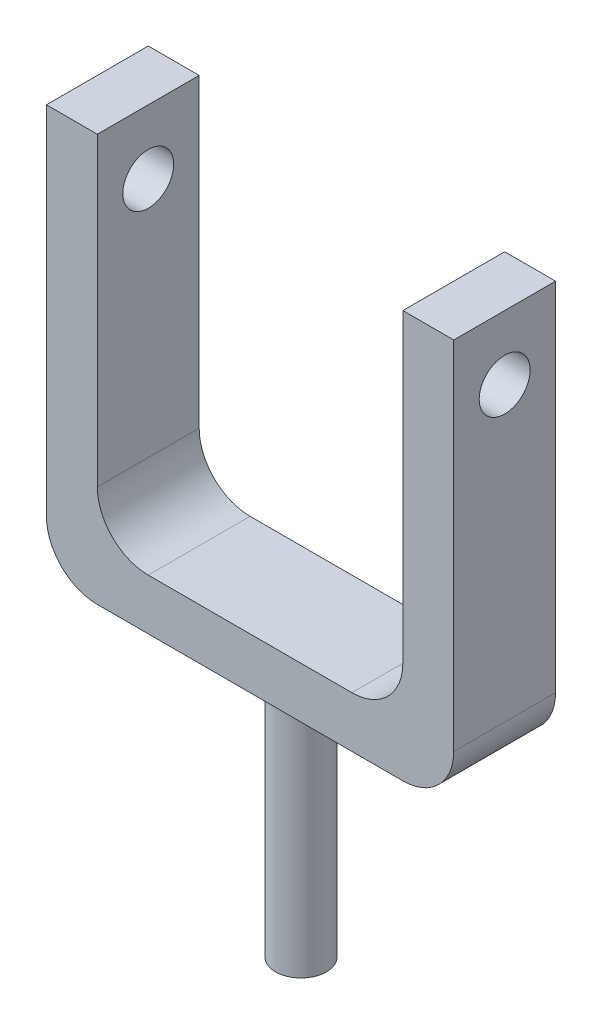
SolidWorks part; units mm, degrees
ref_plane "Front Plane" through (0, 0, 0) normal (0, 0, 1) x (1, 0, 0)
ref_plane "Top Plane" through (0, 0, 0) normal (0, 1, 0) x (1, 0, 0)
ref_plane "Right Plane" through (0, 0, 0) normal (1, 0, 0) x (0, 0, -1)
sketch "Sketch1" plane through (0, 0, 0) normal (0, 0, 1) x (1, 0, 0)
  line L0 (-38.1, 0) -> (38.1, 0)
  line L1 (50.8, 12.7) -> (50.8, 101.6)
  line L2 (50.8, 101.6) -> (38.1, 101.6)
  line L3 (38.1, 101.6) -> (38.1, 25.4)
  line L4 (25.4, 12.7) -> (-25.4, 12.7)
  line L5 (-38.1, 25.4) -> (-38.1, 101.6)
  line L6 (-38.1, 101.6) -> (-50.8, 101.6)
  line L7 (-50.8, 101.6) -> (-50.8, 12.7)
  line L8 (0, 12.7) -> (0, 0) construction
  arc A0 (-38.1, 25.4) -> (-25.4, 12.7) centre (-25.4, 25.4) ccw
  arc A1 (-50.8, 12.7) -> (-38.1, 0) centre (-38.1, 12.7) ccw
  arc A2 (38.1, 25.4) -> (25.4, 12.7) centre (25.4, 25.4) cw
  arc A3 (50.8, 12.7) -> (38.1, 0) centre (38.1, 12.7) cw
  dimension "D2" = 12.7
  dimension "D1" = 12.7
  dimension "D3" = 101.6
  dimension "D4" = 101.6
extrude "Extrude1" add sketch "Sketch1" along normal mid plane 25.4
sketch "Sketch2" plane through (0, 0, 0) normal (0, 1, 0) x (1, 0, 0)
  circle A0 centre (0, 0) radius 6.35
  dimension "D1" = 12.7
extrude "Extrude2" add sketch "Sketch2" against normal blind 63.5
sketch "Sketch3" plane through (0, 0, 0) normal (1, 0, 0) x (0, 0, -1)
  line L1 (0, 101.6) -> (0, 25.4) construction
  line L2 (-12.7, 101.6) -> (12.7, 101.6) construction
  line L3 (-12.7, 25.4) -> (12.7, 25.4) construction
  circle A0 centre (0, 85.598) radius 6.35
  dimension "D1" = 12.7
  dimension "D2" = 16.002
extrude "Cut-Extrude1" cut sketch "Sketch3" against normal up to surface and the other way up to surface
